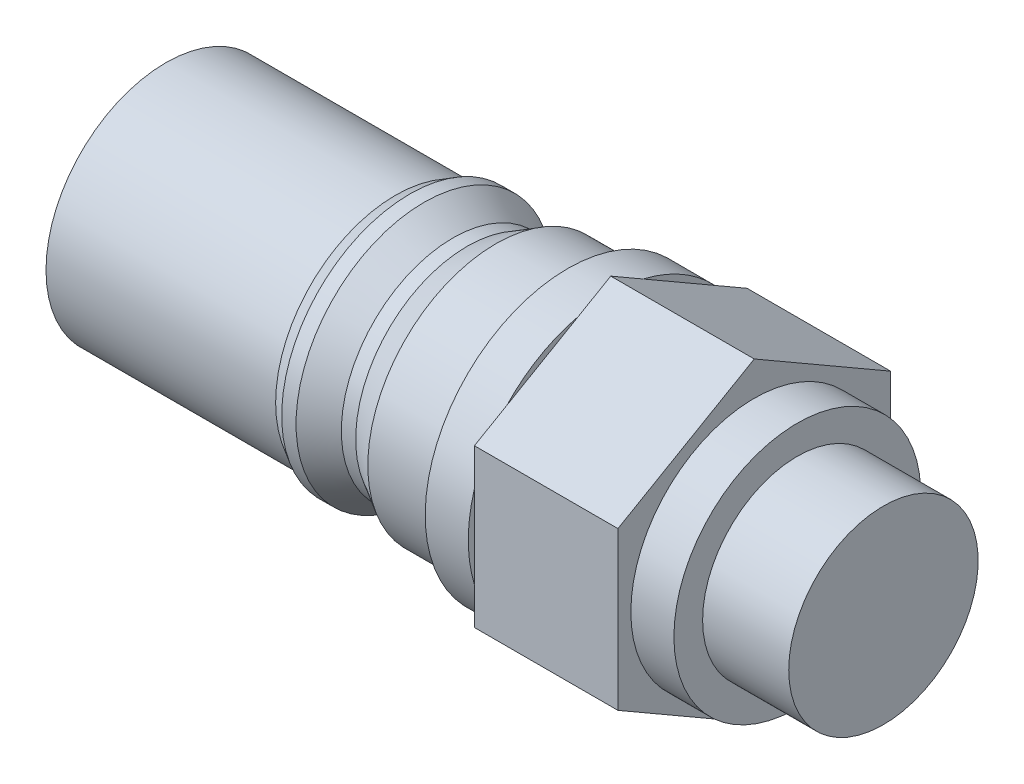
SolidWorks part; units mm, degrees
ref_plane "Alzado" through (0, 0, 0) normal (0, 0, 1) x (1, 0, 0)
ref_plane "Planta" through (0, 0, 0) normal (0, 1, 0) x (1, 0, 0)
ref_plane "Vista lateral" through (0, 0, 0) normal (1, 0, 0) x (0, 0, -1)
sketch "Croquis1" plane through (0, 0, 0) normal (0, 0, 1) x (1, 0, 0)
  line L0 (0, 0) -> (31, 0) construction
  line L1 (0, 0) -> (0, 8.35)
  line L2 (0, 8.35) -> (16, 8.35)
  line L3 (16, 8.35) -> (17, 8.9274)
  line L4 (17, 8.9274) -> (18, 8.9274)
  line L5 (17.5, 8.9274) -> (17.5, 0) construction
  line L6 (19, 8.35) -> (18, 8.9274)
  line L7 (19, 8.35) -> (20, 7.7726)
  line L8 (20, 7.7726) -> (21, 7.7726)
  line L9 (20.5, 7.7726) -> (20.5, 0) construction
  line L10 (22, 8.35) -> (21, 7.7726)
  line L11 (22, 8.35) -> (23, 8.9274)
  line L12 (23, 8.9274) -> (28, 8.9274)
  line L14 (31, 0) -> (0, 0)
  line L15 (28, 8.9274) -> (28, 9.9274)
  line L16 (28, 9.9274) -> (31, 9.9274)
  line L17 (31, 9.9274) -> (31, 0)
  point P18 (27.5743, 0)
  dimension "D1" = 16.7
  dimension "D2" = 16
  dimension "D3" = 1
  dimension "D4" = 1
  dimension "D5" = 150
  dimension "D6" = 1
  dimension "D7" = 1
  dimension "D8" = 5
  dimension "D9" = 1
  dimension "D10" = 3
revolve "Revolución1" add sketch "Croquis1" angle 360 about L14
sketch "Croquis8" plane through (31, 0, 0) normal (1, 0, 0) x (0, 0, -1)
  line L1 (0, 10.9697) -> (-9.5, 5.4848)
  line L2 (-9.5, 5.4848) -> (-9.5, -5.4848)
  line L3 (-9.5, -5.4848) -> (0, -10.9697)
  line L4 (0, -10.9697) -> (9.5, -5.4848)
  line L5 (9.5, -5.4848) -> (9.5, 5.4848)
  line L6 (9.5, 5.4848) -> (0, 10.9697)
  circle A0 centre (0, 0) radius 9.5 construction
  dimension "D1" = 19
extrude "Saliente-Extruir6" add sketch "Croquis8" along normal blind 10
sketch "Croquis10" plane through (0, 0, 0) normal (0, 0, 1) x (1, 0, 0)
  line L0 (41, 0) -> (50, 0) construction
  line L1 (41, 5.4848) -> (41, -5.4848) construction
  line L2 (50, 0) -> (50, 6.6)
  line L3 (50, 6.6) -> (44, 6.6)
  line L4 (44, 6.6) -> (44, 8.6)
  line L5 (44, 8.6) -> (41, 8.6)
  line L6 (41, 8.6) -> (41, 0)
  line L7 (41, 0) -> (50, 0)
  line L8 (41, 0) -> (108.8542, 0) construction
  dimension "D1" = 9
  dimension "D2" = 3
  dimension "D3" = 13.2
  dimension "D4" = 2
revolve "Revolución3" add sketch "Croquis10" angle 360 about L8
